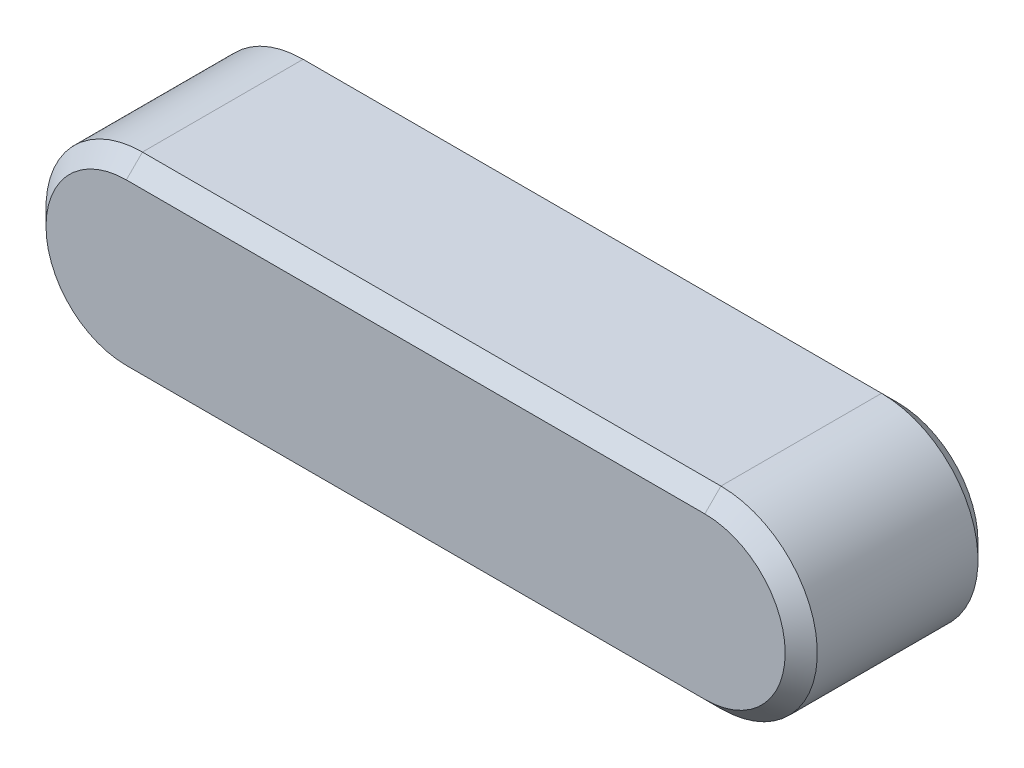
SolidWorks part; units mm, degrees
ref_plane "Plan de face" through (0, 0, 0) normal (0, 0, 1) x (1, 0, 0)
ref_plane "Plan de dessus" through (0, 0, 0) normal (0, 1, 0) x (1, 0, 0)
ref_plane "Plan de droite" through (0, 0, 0) normal (1, 0, 0) x (0, 0, -1)
sketch "Esquisse1" plane through (0, 0, 0) normal (0, 0, 1) x (1, 0, 0)
  line L2 (-287.4618, 423.3277) -> (-305.4618, 423.3277)
  line L3 (-305.4618, 429.3277) -> (-287.4618, 429.3277)
  arc A2 (-305.4618, 429.3277) -> (-305.4618, 423.3277) centre (-305.4618, 426.3277) ccw
  arc A3 (-287.4618, 423.3277) -> (-287.4618, 429.3277) centre (-287.4618, 426.3277) ccw
extrude "Boss.-Extru.1" add sketch "Esquisse1" along normal blind 6
chamfer "Chanfrein1" distance 0.5 angle 45 8 edges at (-284.4618, 426.3277, 6) (-296.4618, 429.3277, 6) (-296.4618, 423.3277, 6) (-308.4618, 426.3277, 6) (-284.4618, 426.3277, 0) (-296.4618, 429.3277, 0) (-296.4618, 423.3277, 0) (-308.4618, 426.3277, 0)
